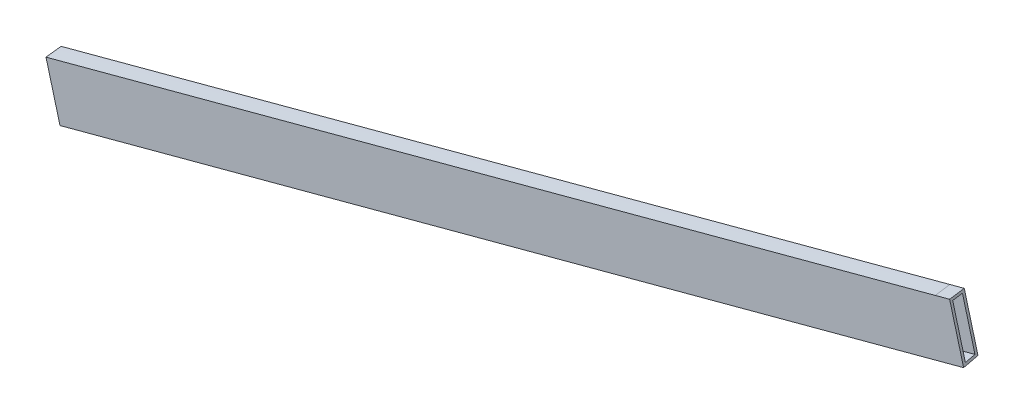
SolidWorks part; units mm, degrees
ref_plane "Front Plane" through (0, 0, 0) normal (0, 0, 1) x (1, 0, 0)
ref_plane "Top Plane" through (0, 0, 0) normal (0, 1, 0) x (1, 0, 0)
ref_plane "Right Plane" through (0, 0, 0) normal (1, 0, 0) x (0, 0, -1)
curve "Curve1"
sketch "Sketch1" plane through (0, 0, 0) normal (1, 0, 0) x (0, 0, -1)
  line L0 (32.5438, 18.2236) -> (32.5438, 2.1862)
  line L1 (0, 0) -> (0, 95.7684) construction
  line L4 (35.7188, 18.6104) -> (35.7187, 2.7868)
  line L5 (33.3375, 17.5323) -> (33.3375, 3.1448)
  line L6 (34.925, 17.7278) -> (34.925, 3.445)
  spline S0 degree 1 poles (34.925, 17.7278) (33.3375, 17.5323) knots 0 0 1 1 construction
  spline S1 degree 1 poles (33.3375, 3.1448) (34.925, 3.445) knots 0 0 1 1 construction
  spline S2 degree 3 poles (34.925, 17.7278) (34.3952, 17.6683) (33.8659, 17.6031) (33.3375, 17.5323) knots 0.373628 0.373628 0.373628 0.373628 0.378966 0.378966 0.378966 0.378966
  spline S3 degree 3 poles (33.3375, 3.1448) (33.8666, 3.2451) (34.3958, 3.3452) (34.925, 3.445) knots 0.626492 0.626492 0.626492 0.626492 0.631768 0.631768 0.631768 0.631768
  spline S4 degree 3 poles (32.5438, 2.1862) (33.6019, 2.3872) (34.6602, 2.5877) (35.7187, 2.7868) knots 0.623361 0.623361 0.623361 0.623361 0.633917 0.633917 0.633917 0.633917
  spline S5 degree 3 poles (35.7188, 18.6104) (34.6579, 18.504) (33.5991, 18.3748) (32.5438, 18.2236) knots 0.370698 0.370698 0.370698 0.370698 0.381261 0.381261 0.381261 0.381261
  dimension "D1" = 0.7937
extrude "Boss-Extrude1" add sketch "Sketch1" along normal blind 25.4
ref_plane "Plane1" through (310.6141, 0, 0) normal (1, 0, 0) x (0, 0, -1)
sketch "Sketch4" plane through (0, 0, -32.5438) normal (0, 0, 1) x (1, 0, 0)
  line L0 (25.4, 2.1862) -> (310.6141, 78.6091)
  line L1 (310.6141, -55) -> (310.6141, 55) construction
  line L2 (25.4, 2.1862) -> (310.6141, 2.1862) construction
  dimension "D1" = 15
sketch "Sketch7" plane through (25.4, 0, 0) normal (1, 0, 0) x (0, 0, -1)
  line L0 (31.75, 18.9118) -> (31.75, 1.2275)
  line L1 (36.5125, 2.1285) -> (36.5125, 19.4877)
  line L6 (32.5438, 18.2236) -> (32.5438, 2.1862)
  line L7 (35.7187, 2.7868) -> (35.7188, 18.6104)
  line L8 (32.5438, 18.2236) -> (32.5438, 2.1862)
  line L9 (35.7187, 2.7868) -> (35.7188, 18.6104)
  spline S0 degree 1 poles (31.75, 1.2275) (36.5125, 2.1285) knots 0 0 1 1 construction
  spline S1 degree 1 poles (36.5125, 19.4877) (31.75, 18.9118) knots 0 0 1 1 construction
  spline S2 degree 3 poles (-1007.3628, 2788.1322) (396.9964, -2913.3467) (-337.2167, 2917.6668) (1068.4864, -2787.387) knots -1.058146 -1.058146 -1.058146 -1.058146 2.288332 2.288332 2.288332 2.288332 only from (32.5438, 2.1862) to (35.7187, 2.7868)
  spline S3 degree 3 poles (-1668.5071, -2414.7589) (2558.4252, 2152.2862) (-2924.5658, -1636.6903) (2862.6229, 967.3231) knots -0.872323 -0.872323 -0.872323 -0.872323 1.778057 1.778057 1.778057 1.778057 only from (35.7188, 18.6104) to (32.5438, 18.2236)
  spline S4 degree 3 poles (32.5438, 2.1862) (33.6019, 2.3872) (34.6602, 2.5877) (35.7187, 2.7868) knots 0.623361 0.623361 0.623361 0.623361 0.633917 0.633917 0.633917 0.633917
  spline S5 degree 3 poles (35.7188, 18.6104) (34.6579, 18.504) (33.5991, 18.3748) (32.5438, 18.2236) knots 0.370698 0.370698 0.370698 0.370698 0.381261 0.381261 0.381261 0.381261
  spline S6 degree 3 poles (31.75, 1.2275) (33.3373, 1.529) (34.9247, 1.8298) (36.5125, 2.1285) knots 0.620228 0.620228 0.620228 0.620228 0.636068 0.636068 0.636068 0.636068
  spline S7 degree 3 poles (36.5125, 19.4877) (34.9214, 19.3282) (33.3329, 19.1385) (31.75, 18.9118) knots 0.367801 0.367801 0.367801 0.367801 0.383534 0.383534 0.383534 0.383534
  dimension "D1" = 0.7937
  dimension "D2" = 0
sweep "Sweep1" add profiles "Sketch7" path "Sketch4"
sketch "Sketch8" plane through (25.4, 0, 0) normal (-1, 0, 0) x (0, 0, 1)
  line L1 (-39.6595, 23.2561) -> (-28.1778, 23.2561)
  line L2 (-39.6595, 23.2561) -> (-39.6595, 0.3529)
  line L3 (-39.6595, 0.3529) -> (-28.1778, 0.3529)
  line L4 (-28.1778, 23.2561) -> (-28.1778, 0.3529)
extrude "Cut-Extrude1" cut sketch "Sketch8" along normal through all
sketch "Sketch9" plane through (0, 0, -31.75) normal (0, 0, 1) x (1, 0, 0)
  line L0 (25.4, 18.9118) -> (29.8211, 2.4121)
  line L1 (25.4, 1.2275) -> (310.6141, 77.6504) construction
  line L2 (29.8211, 2.4121) -> (25.4, 1.2275)
  line L3 (25.4, 1.2275) -> (25.4, 18.9118)
  line L4 (310.6141, 77.6504) -> (306.049, 94.6874)
  line L7 (310.6141, 95.9106) -> (310.6141, 77.6504)
  line L8 (25.4, 19.4877) -> (310.6141, 95.9106) construction
  line L9 (306.049, 94.6874) -> (310.6141, 95.9106)
  dimension "D1" = 15
  dimension "D2" = 15
extrude "Cut-Extrude2" cut sketch "Sketch9" against normal blind 25.4
sketch "Sketch10" plane through (309.2195, 82.8551, 0) normal (0.9659, 0.2588, 0) x (0, 0, -1)
  line L0 (36.5125, -4.5181) -> (36.5125, 12.2497) construction
  line L1 (31.75, 11.6934) -> (31.75, -5.3884) construction
  line L4 (31.75, 11.6934) -> (31.75, -5.3884)
  line L5 (36.5125, -4.5181) -> (36.5125, 12.2497)
  line L6 (32.5438, -4.4623) -> (32.5438, 11.0287) construction
  line L7 (32.5438, -4.4623) -> (32.5438, 11.0287)
  line L8 (35.7187, 11.4022) -> (35.7187, -3.8822) construction
  line L9 (35.7187, 11.4022) -> (35.7187, -3.8822)
  spline S0 degree 3 poles (-496.3278, 2952.211) (1028.4628, -2924.2634) (-857.9599, 2958.2943) (435.1505, -2949.0544) knots -79.607377 -79.607377 -79.607377 -79.607377 71.323976 71.323976 71.323976 71.323976 only from (36.5125, 12.2497) to (31.75, 11.6934) construction
  spline S1 degree 3 poles (36.5125, 12.2497) (34.9215, 12.0956) (33.3334, 11.9124) (31.75, 11.6934) knots 0 0 0 0 1 1 1 1
  spline S2 degree 3 poles (-1120.9227, 2719.6004) (-388.0976, -102.1282) (-179.3344, -44.0586) (32.9419, -5.1698) (33.3392, -5.097) (33.7365, -5.0243) (34.1338, -4.9517) (243.402, 33.3025) (457.0514, 47.6475) (1168.9394, -2740.5419) knots -0.646216 -0.646216 -0.646216 -0.646216 0.001212 0.001212 0.001212 0.002423 0.002423 0.002423 0.640631 0.640631 0.640631 0.640631 only from (31.75, -5.3884) to (36.5125, -4.5181) construction
  spline S3 degree 3 poles (31.75, -5.3884) (32.1473, -5.3155) (32.5446, -5.2426) (32.9419, -5.1698) (33.3392, -5.097) (33.7365, -5.0243) (34.1338, -4.9517) (34.9266, -4.8067) (35.7195, -4.6622) (36.5125, -4.5181) knots 0 0 0 0 0.001212 0.001212 0.001212 0.002423 0.002423 0.002423 0.004841 0.004841 0.004841 0.004841
  spline S4 degree 3 poles (2527.8274, 1648.9387) (-2469.1348, -2402.3563) (1889.7752, 2768.3014) (-883.0176, -2809.393) knots -161.410737 -161.410737 -161.410737 -161.410737 130.699627 130.699627 130.699627 130.699627 only from (32.5438, 11.0287) to (35.7187, 11.4022) construction
  spline S5 degree 3 poles (32.5438, 11.0287) (33.5994, 11.1747) (34.658, 11.2995) (35.7187, 11.4022) knots 0 0 0 0 1 1 1 1
  spline S6 degree 3 poles (1048.4984, -2800.8926) (376.0017, 29.7133) (202.9523, 26.6022) (34.924, -4.0268) (34.6591, -4.0751) (34.3942, -4.1235) (34.1293, -4.1719) (-136.8112, -35.4156) (-303.3835, -90.5686) (-999.7189, 2783.7626) knots -0.511584 -0.511584 -0.511584 -0.511584 0.000808 0.000808 0.000808 0.001616 0.001616 0.001616 0.522933 0.522933 0.522933 0.522933 only from (35.7187, -3.8822) to (32.5438, -4.4623) construction
  spline S7 degree 3 poles (35.7187, -3.8822) (35.4538, -3.9303) (35.1889, -3.9785) (34.924, -4.0268) (34.6591, -4.0751) (34.3942, -4.1235) (34.1293, -4.1719) (33.6007, -4.2685) (33.0722, -4.3653) (32.5438, -4.4623) knots 0 0 0 0 0.000808 0.000808 0.000808 0.001616 0.001616 0.001616 0.003228 0.003228 0.003228 0.003228
  point P2 (36.5125, 3.8658)
extrude "Boss-Extrude2" add sketch "Sketch10" along normal blind 4.699
